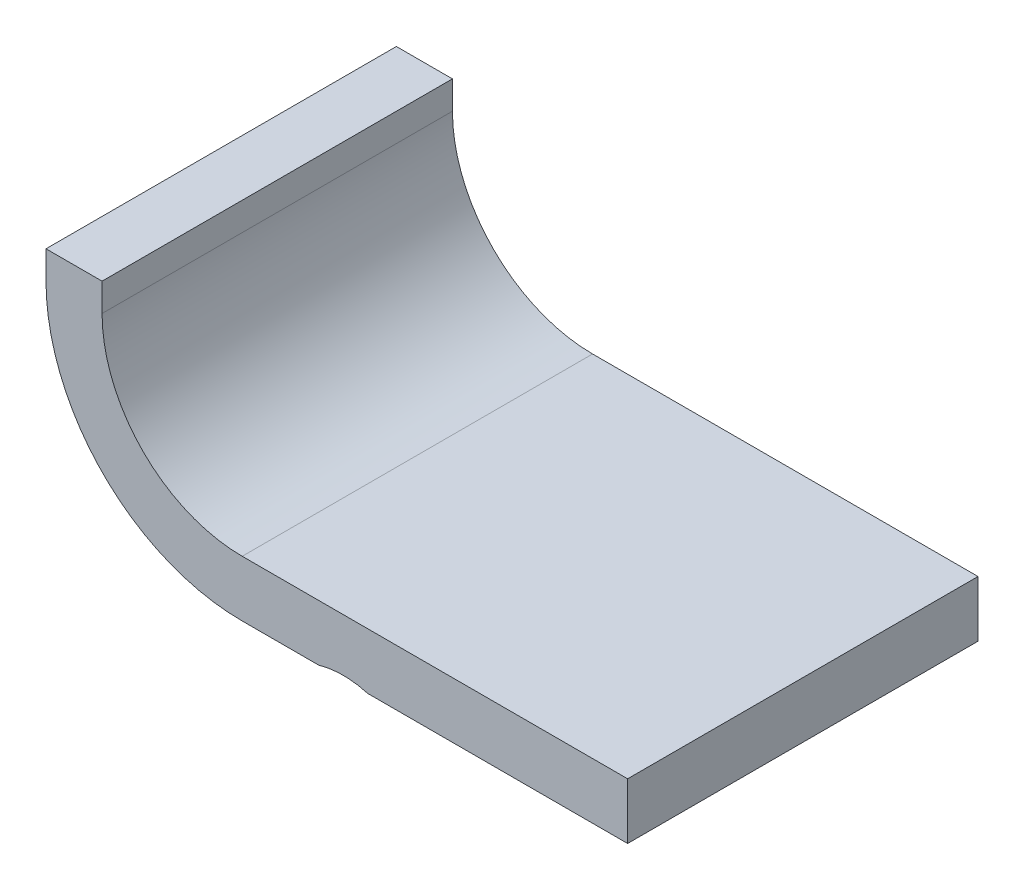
SolidWorks part; units mm, degrees
ref_plane "Face" through (0, 0, 0) normal (0, 0, 1) x (1, 0, 0)
ref_plane "Dessus" through (0, 0, 0) normal (0, 1, 0) x (1, 0, 0)
ref_plane "Droite" through (0, 0, 0) normal (1, 0, 0) x (0, 0, -1)
sketch "Esquisse1" plane through (0, 0, 0) normal (0, 0, 1) x (1, 0, 0)
  line L0 (0, 0) -> (-55, 0)
  line L1 (-83, 28) -> (-83, 32)
  line L2 (0, 8) -> (-55, 8)
  line L3 (-75, 28) -> (-75, 32)
  line L4 (-83, 32) -> (-75, 32)
  line L5 (0, 8) -> (0, 0)
  arc A0 (-55, 0) -> (-83, 28) centre (-55, 28) cw
  arc A1 (-55, 8) -> (-75, 28) centre (-55, 28) cw
  dimension "D1" = 28
  dimension "D2" = 55
  dimension "D3" = 4
  dimension "D4" = 8
extrude "Extrusion1" add sketch "Esquisse1" along normal blind 50
sketch "Esquisse2" plane through (0, 0, 0) normal (0, 0, -1) x (-1, 0, 0)
  line L0 (0, 0) -> (0, 8) construction
  line L1 (55, 0) -> (0, 0) construction
  circle A0 centre (40.6, -12) radius 12.5
  dimension "D1" = 25
  dimension "D2" = 40.6
  dimension "D3" = 12
extrude "Enlèv. mat.-Extru.1" cut sketch "Esquisse2" against normal through all
